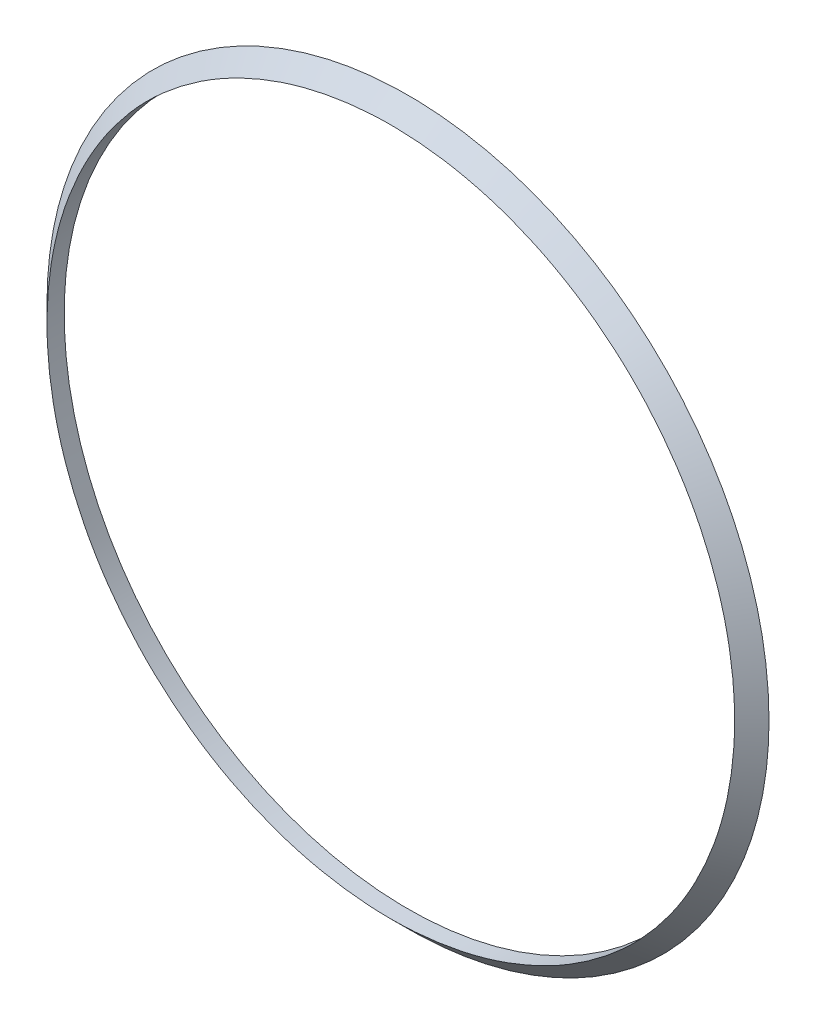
SolidWorks part; units mm, degrees
other "Objet de détail1"
ref_plane "Face" through (0, 0, 0) normal (0, 0, 1) x (1, 0, 0)
ref_plane "Dessus" through (0, 0, 0) normal (0, 1, 0) x (1, 0, 0)
ref_plane "Droite" through (0, 0, 0) normal (1, 0, 0) x (0, 0, -1)
other "Cordon de soudure1"
